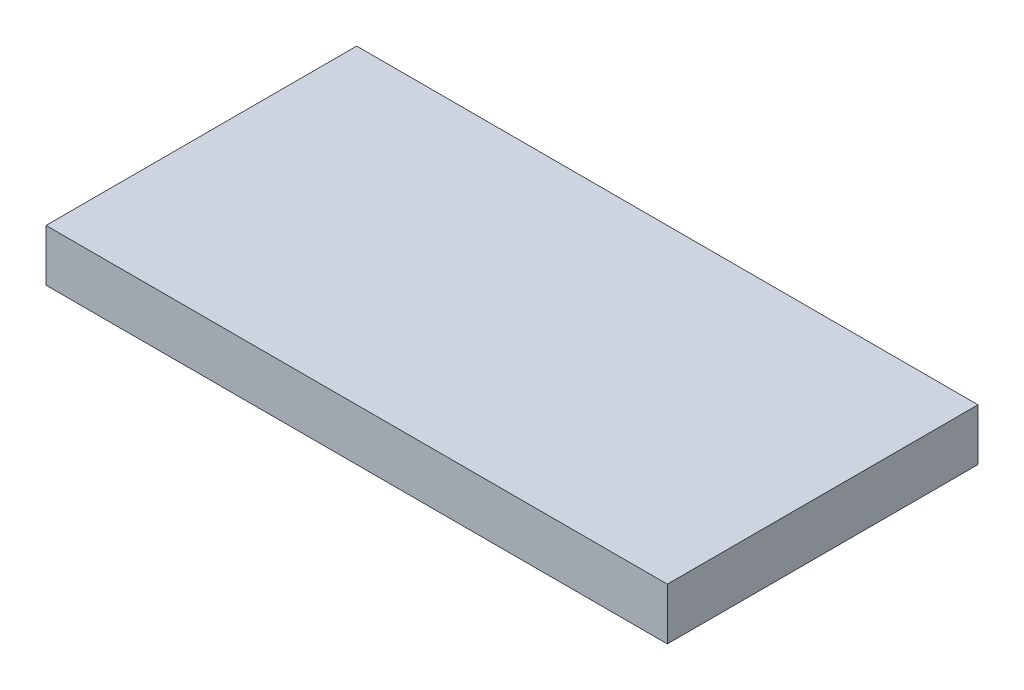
SolidWorks part; units mm, degrees
ref_plane "Front Plane" through (0, 0, 0) normal (0, 0, 1) x (1, 0, 0)
ref_plane "Top Plane" through (0, 0, 0) normal (0, 1, 0) x (1, 0, 0)
ref_plane "Right Plane" through (0, 0, 0) normal (1, 0, 0) x (0, 0, -1)
sketch "Sketch1" plane through (0, 0, 0) normal (0, 1, 0) x (1, 0, 0)
  line L1 (-76.2, 38.1) -> (76.2, 38.1)
  line L2 (-76.2, 38.1) -> (-76.2, -38.1)
  line L3 (-76.2, -38.1) -> (76.2, -38.1)
  line L4 (76.2, 38.1) -> (76.2, -38.1)
  dimension "D1" = 152.4
  dimension "D2" = 76.2
  dimension "D3" = 76.2
  dimension "D4" = 38.1
extrude "Extrude1" add sketch "Sketch1" along normal blind 12.7
